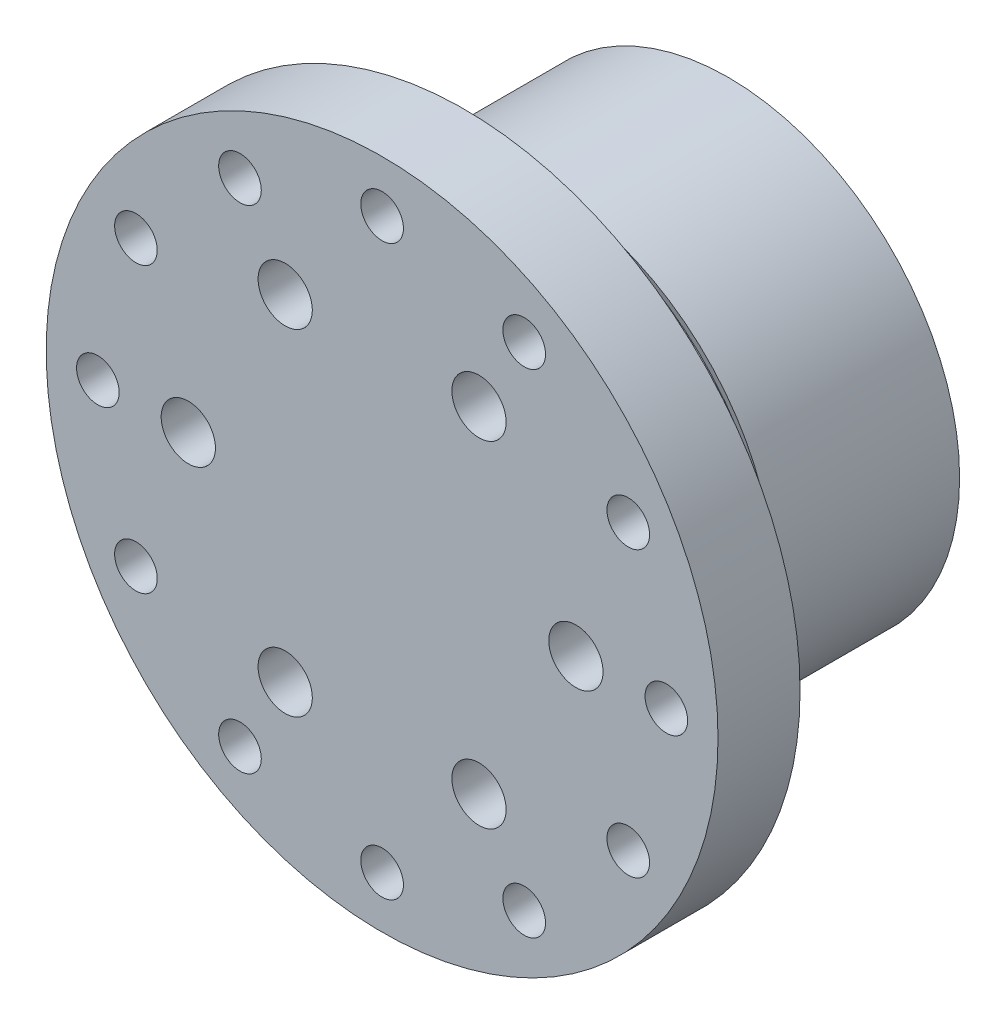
SolidWorks part; units mm, degrees
ref_plane "Front Plane" through (0, 0, 0) normal (1, 0, 0) x (0, 1, 0)
ref_plane "Top Plane" through (0, 0, 0) normal (0, 0, 1) x (0, 1, 0)
ref_plane "Right Plane" through (0, 0, 0) normal (0, 1, 0) x (-1, 0, 0)
sketch "Sketch1" plane through (0, 0, 0) normal (0, 0, 1) x (0, 1, 0)
  circle A0 centre (0, 0) radius 18.9
  dimension "D1" = 37.8
extrude "Boss-Extrude1" add sketch "Sketch1" along normal blind 20.45
sketch "Sketch4" plane through (0, 0, 20.45) normal (0, 0, 1) x (1, 0, 0)
  circle A0 centre (0, 0) radius 26
  dimension "D1" = 52
extrude "Boss-Extrude2" add sketch "Sketch4" along normal blind 6.35
sketch "Sketch2" plane through (0, 0, 26.8) normal (0, 0, 1) x (1, 0, 0)
  line L0 (0, 0) -> (15, 0) construction
  circle A0 centre (15, 0) radius 2.1
  circle A1 centre (7.5, -12.9904) radius 2.1
  circle A2 centre (-7.5, -12.9904) radius 2.1
  circle A3 centre (-15, 0) radius 2.1
  circle A4 centre (-7.5, 12.9904) radius 2.1
  circle A5 centre (7.5, 12.9904) radius 2.1
  dimension "D3" = 4.2
  dimension "D2" = 15
  dimension "D1" = 6
extrude "Cut-Extrude1" cut sketch "Sketch2" against normal through all both and the other way through all
sketch "Sketch3" plane through (0, 0, 0) normal (0, 0, -1) x (1, 0, 0)
  line L0 (0, 0) -> (12.3409, 7.125) construction
  line L1 (0, 0) -> (15, 0) construction
  line L2 (7.5, 12.9904) -> (0, 0) construction
  circle A0 centre (12.3409, 7.125) radius 3
  circle A1 centre (0, -14.25) radius 3
  circle A2 centre (-12.3409, 7.125) radius 3
  dimension "D2" = 6
  dimension "D1" = 14.25
  dimension "D3" = 30
  dimension "D4" = 3
extrude "Cut-Extrude2" cut sketch "Sketch3" against normal blind 4
sketch "Sketch5" plane through (0, 0, 26.8) normal (0, 0, 1) x (1, 0, 0)
  line L0 (0, 0) -> (22, 0) construction
  circle A0 centre (22, 0) radius 1.65
  circle A1 centre (19.0526, -11) radius 1.65
  circle A2 centre (11, -19.0526) radius 1.65
  circle A3 centre (0, -22) radius 1.65
  circle A4 centre (-11, -19.0526) radius 1.65
  circle A5 centre (-19.0526, -11) radius 1.65
  circle A6 centre (-22, 0) radius 1.65
  circle A7 centre (-19.0526, 11) radius 1.65
  circle A8 centre (-11, 19.0526) radius 1.65
  circle A9 centre (0, 22) radius 1.65
  circle A10 centre (11, 19.0526) radius 1.65
  circle A11 centre (19.0526, 11) radius 1.65
  dimension "D2" = 3.3
  dimension "D1" = 22
  dimension "D3" = 12
extrude "Cut-Extrude3" cut sketch "Sketch5" against normal through all
sketch "Sketch6" plane through (0, 0, 0) normal (0, 0, -1) x (1, 0, 0)
  circle A0 centre (0, 0) radius 18.9
  circle A2 centre (0, 0) radius 18.9 construction
  circle A3 centre (0, 0) radius 17.9
  dimension "D1" = 35.8
extrude "Cut-Extrude4" cut sketch "Sketch6" against normal offset from surface (15.35 mm away) 5.1
chamfer "Chamfer1" distance 1 angle 45 1 edges at (17.9, 0, 15.35)
